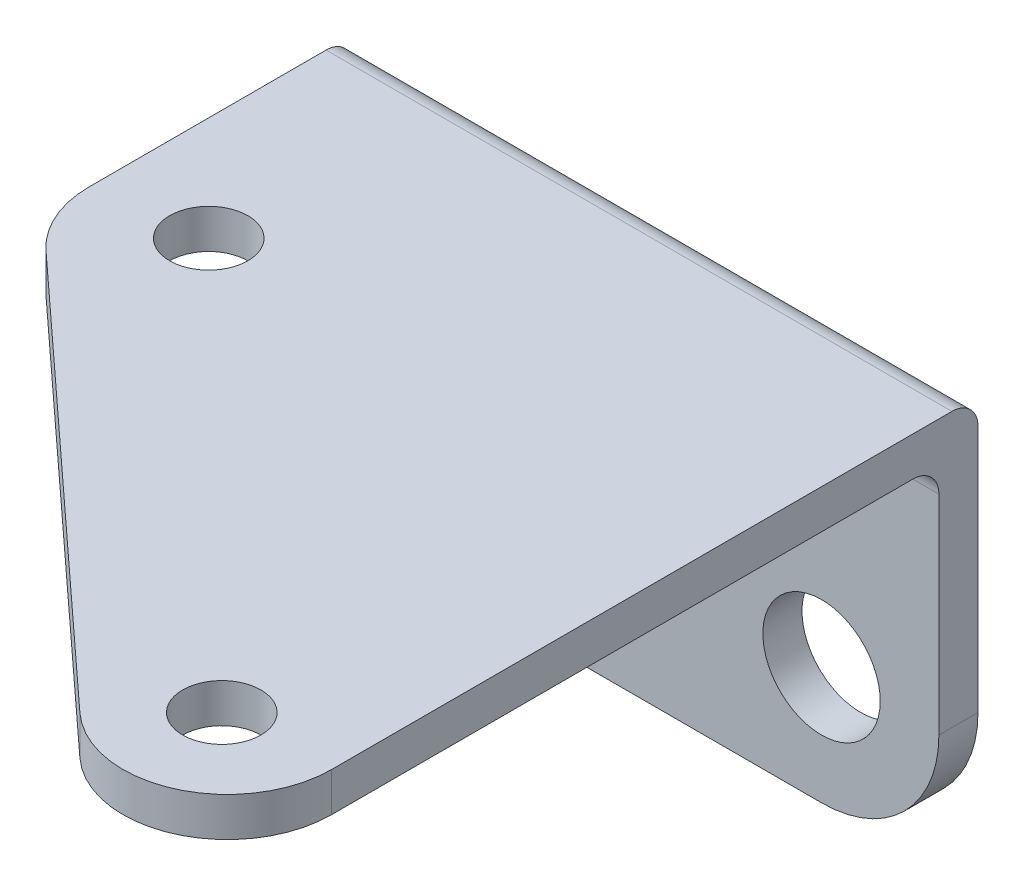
SolidWorks part; units mm, degrees
ref_plane "Front Plane" through (0, 0, 0) normal (0, 0, 1) x (1, 0, 0)
ref_plane "Top Plane" through (0, 0, 0) normal (0, 1, 0) x (1, 0, 0)
ref_plane "Right Plane" through (0, 0, 0) normal (1, 0, 0) x (0, 0, -1)
sketch "Sketch1" plane through (0, 0, 0) normal (0, 0, 1) x (1, 0, 0)
  line L1 (0, 0) -> (-48, 0)
  line L2 (0, 0) -> (0, -27)
  line L3 (0, -27) -> (-48, -27)
  line L4 (-48, 0) -> (-48, -27)
  circle A0 centre (-39, -18) radius 4.5
  circle A1 centre (-9, -18) radius 4.5
  dimension "D1" = 9
  dimension "D3" = 30
  dimension "D2" = 27
  dimension "D4" = 18
  dimension "D5" = 9
  dimension "D6" = 48
extrude "Boss-Extrude1" add sketch "Sketch1" along normal blind 3
fillet "Fillet1" radius 9 2 edges at (0, -27, 1.5) (-48, -27, 1.5)
ref_plane "Plane1" through (0, 0, 0) normal (0, 1, 0) x (1, 0, 0)
sketch "Sketch2" plane through (0, 0, 0) normal (0, 1, 0) x (1, 0, 0)
  line L0 (0, 0) -> (0, -67.7905)
  line L1 (0, 0) -> (-48, 0)
  line L2 (-48, -23.6919) -> (0, -67.7905)
  line L4 (-48, 0) -> (-48, -23.6919)
  line L5 (0, -3) -> (-48, -3) construction
  circle A0 centre (-40, -19) radius 3
  circle A1 centre (-8, -50) radius 3
  dimension "D1" = 6
  dimension "D3" = 32
  dimension "D4" = 31
  dimension "D5" = 8
  dimension "D6" = 16
extrude "Boss-Extrude2" add sketch "Sketch2" along normal blind 3
fillet "Fillet2" radius 8 1 edges at (0, 1.5, 67.7905)
fillet "Fillet3" radius 8 1 edges at (-48, 1.5, 23.6919)
fillet "Fillet4" radius 2 2 edges at (-24, 3, 0) (-24, 0, 3)
